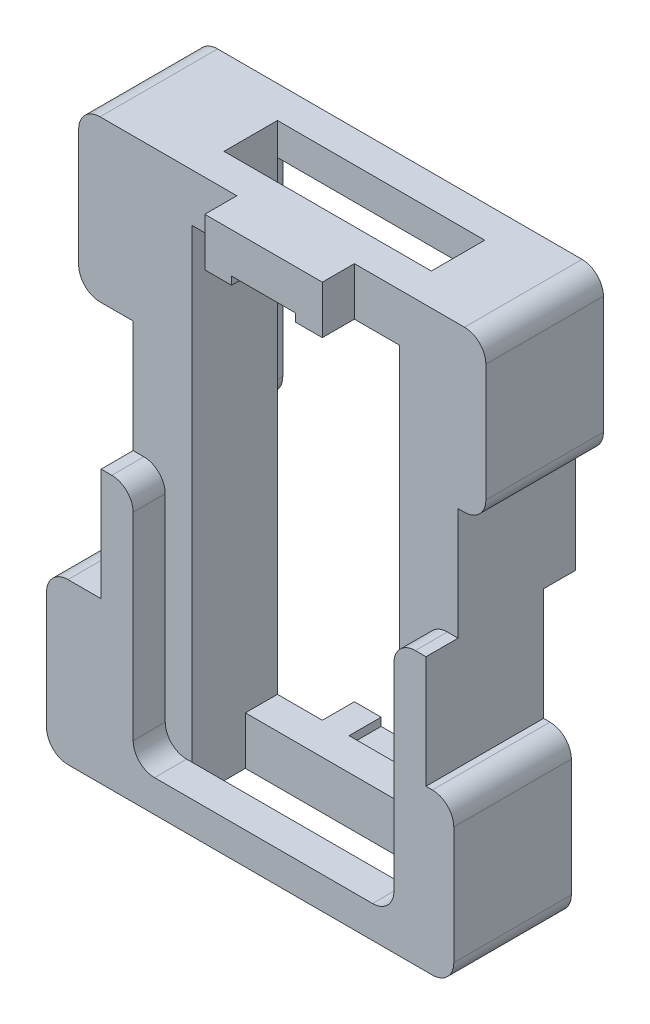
SolidWorks part; units mm, degrees
ref_plane "Front Plane" through (0, 0, 0) normal (0, 0, 1) x (1, 0, 0)
ref_plane "Top Plane" through (0, 0, 0) normal (0, 1, 0) x (1, 0, 0)
ref_plane "Right Plane" through (0, 0, 0) normal (1, 0, 0) x (0, 0, -1)
sketch "values-params_print" plane through (0, 0, 0) normal (0, 0, 1) x (1, 0, 0)
  line L0 (0, 0) -> (0.7, 0) construction
  line L1 (0, -5.2349) -> (3, -5.2349) construction
  line L2 (0, -10.104) -> (4, -10.104) construction
  line L3 (0, -15.1093) -> (100, -15.1093) construction
  line L4 (0, -19.837) -> (0.15, -19.837) construction
  line L5 (0, -24.2596) -> (0.3, -24.2596) construction
  line L6 (0, -28.606) -> (3.175, -28.606) construction
  line L7 (0, -33.0286) -> (9.5, -33.0286) construction
  line L8 (0, -37.6038) -> (2.4, -37.6038) construction
  line L9 (0, -43.1661) -> (6.35, -43.1661) construction
  dimension "width destroy" = 0.7
  dimension "width keep" = 3
  dimension "width tab" = 4
  dimension "base diameter" = 100
  dimension "print fit" = 0.15
  dimension "print free" = 0.3
  dimension "pin diameter" = 3.175
  dimension "pulley diameter" = 9.5
  dimension "pulley thickness" = 2.4
  dimension "base pin diameter" = 6.35
inserted part "params_print"
sketch "Body" plane through (0, 0, 0) normal (0, 0, 1) x (1, 0, 0)
  line L0 (0, 22.5) -> (0, -22.5) construction
  line L1 (-12.2, -22.5) -> (12.2, -22.5) construction
  line L2 (-12.2, -22.5) -> (-12.2, 22.5) construction
  line L3 (-12.2, 22.5) -> (12.2, 22.5) construction
  line L4 (12.2, -22.5) -> (12.2, 22.5) construction
  line L5 (-12.2, 0) -> (12.2, 0) construction
  line L6 (0, 22.5) -> (0, 25.5) construction
  line L7 (-9.7, 21) -> (9.7, 21)
  line L8 (-9.7, 21) -> (-9.7, -21)
  line L9 (-9.7, -21) -> (9.7, -21)
  line L10 (9.7, 21) -> (9.7, -21)
  line L11 (-15.2, 25.5) -> (15.2, 25.5)
  line L12 (-15.2, 25.5) -> (-15.2, -25.5)
  line L13 (-15.2, -25.5) -> (15.2, -25.5)
  line L14 (15.2, 25.5) -> (15.2, -25.5)
  line L15 (-12.2, 0) -> (-15.2, 0) construction
  circle A0 centre (0, 12.5) radius 8.5 construction
  dimension "D3" = 10
  dimension "D4" = 17
  dimension "DynWidth" = 24.4
  dimension "DynHeight" = 45
  dimension "D5" = 2.5
  dimension "D6" = 3
extrude "Main Body" add sketch "Body" along normal mid plane 8
sketch "Sketch2" plane through (0, 0, 4) normal (0, 0, 1) x (1, 0, 0)
  line L0 (-15.2, 0) -> (15.2, 0) construction
  line L1 (-15.2, 25.5) -> (-15.2, -25.5) construction
  line L2 (15.2, -25.5) -> (15.2, 25.5) construction
  line L3 (0, 25.5) -> (0, -25.5) construction
  line L4 (15.2, 25.5) -> (-15.2, 25.5) construction
  line L5 (-15.2, -25.5) -> (15.2, -25.5) construction
  line L6 (-12.2, 0) -> (-15.2, 0)
  line L7 (-15.2, 0) -> (-15.2, -25.5)
  line L8 (-12.2, 0) -> (-12.2, -22.5)
  line L9 (-12.2, -22.5) -> (12.2, -22.5)
  line L10 (12.2, 0) -> (12.2, -22.5)
  line L11 (-15.2, -25.5) -> (15.2, -25.5)
  line L12 (15.2, -25.5) -> (15.2, 0)
  line L13 (15.2, 0) -> (12.2, 0)
  line L14 (-15.2, 22.5) -> (15.2, 22.5) construction
  line L15 (-5.5, 25.5) -> (5.5, 25.5)
  line L16 (-5.5, 25.5) -> (-5.5, 21)
  line L17 (9.7, 21) -> (-9.7, 21) construction
  line L18 (-5.5, 21) -> (-3, 21)
  line L19 (-3, 21) -> (-3, 21.75)
  line L20 (-3, 21.75) -> (3, 21.75)
  line L21 (3, 21.75) -> (3, 21)
  line L22 (3, 21) -> (5.5, 21)
  line L23 (5.5, 21) -> (5.5, 25.5)
  circle A0 centre (0, 12.5) radius 8.5 construction
  dimension "D4" = 17
  dimension "D5" = 10
  dimension "D1" = 22.5
  dimension "D2" = 24.4
  dimension "D3" = 11
  dimension "D6" = 6
  dimension "D7" = 21.75
extrude "Clamp Walls 1" add sketch "Sketch2" along normal blind 3 and the other way up to surface
sketch "Sketch3" plane through (0, 0, -4) normal (0, 0, -1) x (-1, 0, 0)
  line L0 (0, -25.5) -> (0, 25.5) construction
  line L1 (15.2, -25.5) -> (-15.2, -25.5) construction
  line L2 (-15.2, 25.5) -> (15.2, 25.5) construction
  line L3 (15.2, 0) -> (-15.2, 0) construction
  line L4 (15.2, 25.5) -> (15.2, -25.5) construction
  line L5 (-15.2, -25.5) -> (-15.2, 25.5) construction
  line L6 (15.2, 0) -> (15.2, 25.5)
  line L7 (15.2, 25.5) -> (-15.2, 25.5)
  line L8 (-15.2, 25.5) -> (-15.2, 0)
  line L9 (-15.2, 0) -> (-12.2, 0)
  line L10 (-12.2, 0) -> (-12.2, 22.5)
  line L11 (-12.2, 22.5) -> (12.2, 22.5)
  line L12 (12.2, 22.5) -> (12.2, 0)
  line L13 (12.2, 0) -> (15.2, 0)
  line L14 (5.5, -25.5) -> (5.5, -21)
  line L15 (9.7, -21) -> (-9.7, -21) construction
  line L16 (5.5, -21) -> (3, -21)
  line L17 (3, -21) -> (3, -21.75)
  line L18 (3, -21.75) -> (-3, -21.75)
  line L19 (-3, -21.75) -> (-3, -21)
  line L20 (-3, -21) -> (-5.5, -21)
  line L21 (-5.5, -21) -> (-5.5, -25.5)
  line L22 (-5.5, -25.5) -> (5.5, -25.5)
  dimension "D1" = 24.4
  dimension "D2" = 22.5
  dimension "D3" = 11
  dimension "D4" = 6
  dimension "D5" = 21.75
extrude "Clamp Walls 2" add sketch "Sketch3" along normal blind 3
sketch "Sketch7" plane through (-15.2, 0, 0) normal (-1, 0, 0) x (0, 0, 1)
  line L0 (-4, 0) -> (-4, -25.5) construction
  line L1 (7, -25.5) -> (-4, -25.5)
  line L2 (7, -25.5) -> (7, -10.5)
  line L3 (7, -10.5) -> (-4, -10.5)
  line L4 (-4, -25.5) -> (-4, -10.5)
  line L6 (4, 25.5) -> (4, 0) construction
  line L7 (-7, 25.5) -> (4, 25.5)
  line L8 (-7, 25.5) -> (-7, 10.5)
  line L9 (-7, 10.5) -> (4, 10.5)
  line L10 (7, 0) -> (-7, 0) construction
  line L11 (4, 25.5) -> (4, 10.5)
  dimension "D1" = 15
extrude "Standoff 1" add sketch "Sketch7" along normal blind 5.1
sketch "Sketch8" plane through (15.2, 0, 0) normal (1, 0, 0) x (0, 0, -1)
  line L0 (-7, -25.5) -> (-7, 0) construction
  line L1 (4, -25.5) -> (-7, -25.5)
  line L2 (4, -25.5) -> (4, -10.5)
  line L3 (4, -10.5) -> (-7, -10.5)
  line L4 (-7, -25.5) -> (-7, -10.5)
  line L5 (-4, 0) -> (-4, 25.5) construction
  line L6 (7, 25.5) -> (-4, 25.5)
  line L7 (7, 25.5) -> (7, 10.5)
  line L8 (7, 10.5) -> (-4, 10.5)
  line L9 (-4, 25.5) -> (-4, 10.5)
  line L10 (7, 25.5) -> (7, 10.5) construction
extrude "Standoff 2" add sketch "Sketch8" along normal blind 2.6
fillet "Contouring" radius 2 16 edges at (-20.3, -10.5, 1.5) (-20.3, 10.5, -1.5) (17.8, 10.5, -1.5) (17.8, -10.5, 1.5) (-12.2, 0, 5.5) (12.2, 0, 5.5) (12.2, 0, -5.5) (-12.2, 0, -5.5) (12.2, 22.5, -5.5) (-12.2, 22.5, -5.5) (-12.2, -22.5, 5.5) (12.2, -22.5, 5.5) (-20.3, -25.5, 1.5) (-20.3, 25.5, -1.5) (17.8, 25.5, -1.5) (17.8, -25.5, 1.5)
sketch "Sketch11" plane through (0, 25.5, 0) normal (0, 1, 0) x (1, 0, 0)
  line L0 (15.8, 1.5) -> (-20.3, 1.5) construction
  line L4 (-9.7, -4) -> (-9.7, 4) construction
  line L5 (9.7, -4) -> (9.7, 4) construction
  line L6 (15.8, -4) -> (15.8, 7) construction
  line L7 (-9.7, -1) -> (-9.7, 4)
  line L8 (9.7, -1) -> (9.7, 4)
  line L9 (-20.3, -4) -> (-20.3, 7) construction
  line L14 (15.8, -4) -> (5.5, -4) construction
  line L15 (9.7, -1) -> (-9.7, -1)
  line L17 (9.7, 4) -> (-9.7, 4)
  dimension "D1" = 3
extrude "Ventilation 1" cut sketch "Sketch11" against normal up to surface (4.5 mm away)
sketch "Sketch12" plane through (0, -25.5, 0) normal (0, -1, 0) x (1, 0, 0)
  line L0 (-16.4, 1.5) -> (15.8, 1.5) construction
  line L2 (15.8, -4) -> (15.8, 7) construction
  line L7 (-9.7, 4) -> (9.7, 4)
  line L8 (-9.7, 4) -> (-9.7, -1)
  line L9 (-9.7, -1) -> (9.7, -1)
  line L10 (9.7, 4) -> (9.7, -1)
  line L11 (-9.7, -4) -> (-9.7, 1) construction
  line L12 (-9.7, 1) -> (9.7, 1) construction
extrude "Ventilation 2" cut sketch "Sketch12" against normal up to surface (4.5 mm away)
ref_point "Ref Center"
equation "\"D6@Body\" = \"width keep@values@params_print.sldprt\""
equation "\"D1@Sketch2\"=\"DynHeight@Body\"/2"
equation "\"D2@Sketch2\"=\"DynWidth@Body\""
equation "\"D7@Sketch2\"=\"DynHeight@Body\"/2-0.75"
equation "\"D1@Sketch3\"=\"DynWidth@Body\""
equation "\"D2@Sketch3\"=\"DynHeight@Body\"/2"
equation "\"D5@Sketch3\"=\"DynHeight@Body\"/2-0.75"
equation "\"D1@Clamp Walls 1\" = \"width keep@values@params_print.sldprt\""
equation "\"D1@Clamp Walls 2\" = \"width keep@values@params_print.sldprt\""
equation "\"D1@Standoff 2\" = 5.6 - \"width keep@values@params_print.sldprt\""
equation "\"D1@Sketch11\" = \"width keep@values@params_print.sldprt\""
equation "\"D1@Standoff 1\" = 5.6 + 2.5 - \"width keep@values@params_print.sldprt\""
